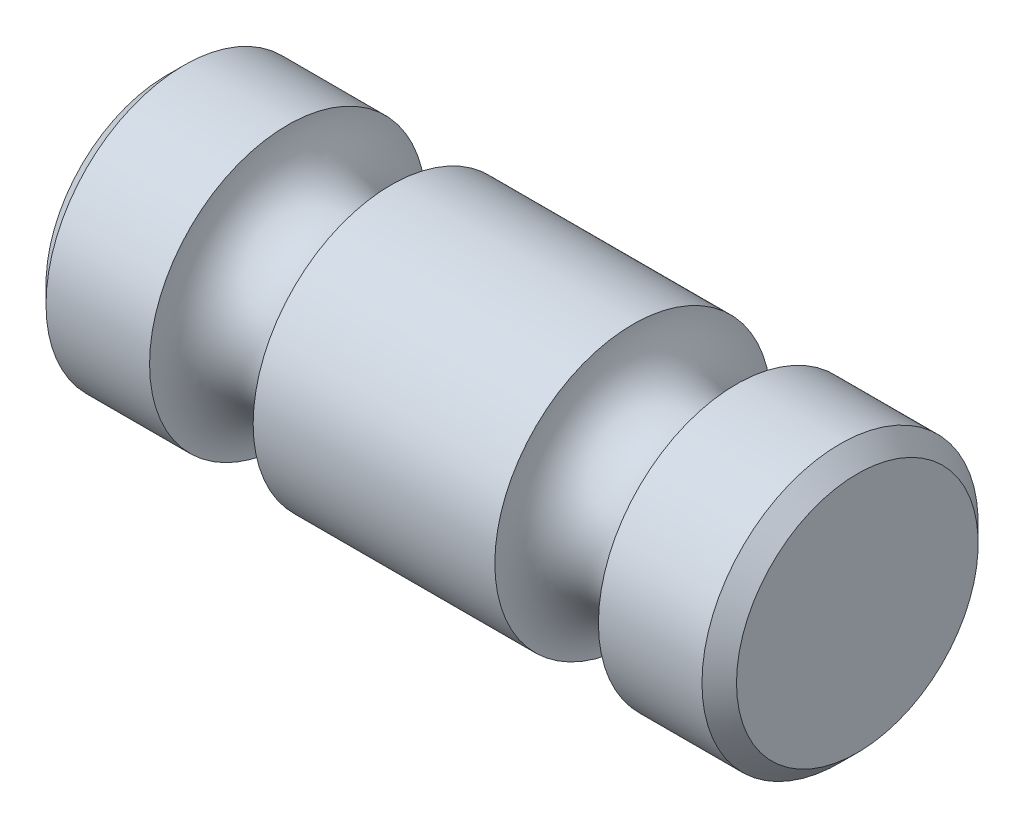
SolidWorks part; units mm, degrees
ref_plane "Face" through (0, 0, 0) normal (0, 0, 1) x (1, 0, 0)
ref_plane "Dessus" through (0, 0, 0) normal (0, 1, 0) x (1, 0, 0)
ref_plane "Droite" through (0, 0, 0) normal (1, 0, 0) x (0, 0, -1)
sketch "Esquisse1" plane through (0, 0, 0) normal (0, 0, 1) x (1, 0, 0)
  line L0 (-57.3101, 14.3483) -> (-50.3101, 14.3483)
  line L1 (-44.3101, 14.3483) -> (-30.3101, 14.3483)
  line L2 (-24.3101, 14.3483) -> (-17.3101, 14.3483)
  line L4 (-57.3101, 14.3483) -> (-57.3101, 6.3483)
  line L5 (-57.3101, 6.3483) -> (-17.3101, 6.3483)
  line L6 (-17.3101, 6.3483) -> (-17.3101, 14.3483)
  line L7 (-63.2212, 6.3483) -> (-13.7663, 6.3483) construction
  arc A0 (-50.3101, 14.3483) -> (-44.3101, 14.3483) centre (-47.3101, 14.3483) ccw
  arc A1 (-30.3101, 14.3483) -> (-24.3101, 14.3483) centre (-27.3101, 14.3483) ccw
  dimension "D1" = 10
  dimension "D4" = 3
  dimension "D5" = 8
  dimension "D2" = 40
  dimension "D3" = 10
revolve "Révolution1" add sketch "Esquisse1" angle 360 about L7
chamfer "Chanfrein3" distance 1 angle 45
